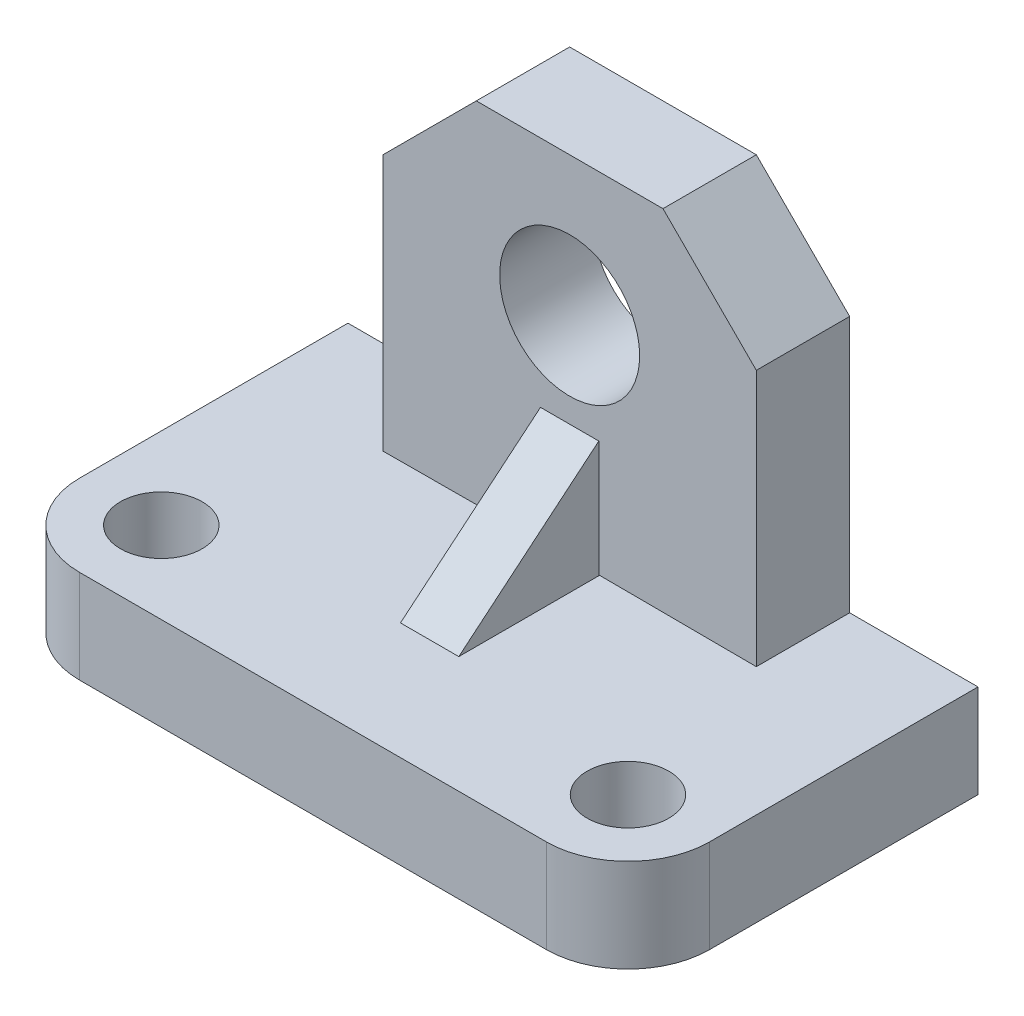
SolidWorks part; units mm, degrees
ref_plane "前视基准面" through (0, 0, 0) normal (0, 0, 1) x (1, 0, 0)
ref_plane "上视基准面" through (0, 0, 0) normal (0, 1, 0) x (1, 0, 0)
ref_plane "右视基准面" through (0, 0, 0) normal (1, 0, 0) x (0, 0, -1)
sketch "草图1" plane through (0, 0, 0) normal (0, 1, 0) x (1, 0, 0)
  line L0 (0, 22.9704) -> (0, -68.59) construction
  line L1 (27, 0) -> (-27, 0)
  line L2 (-27, 0) -> (-27, -23)
  line L3 (-20, -30) -> (20, -30)
  line L4 (-20, -15.9026) -> (-20, -39.6762) construction
  line L5 (-11.9684, -23) -> (-5.1768, -23) construction
  line L6 (27, 0) -> (27, -23)
  circle A0 centre (-20, -23) radius 3.5
  arc A1 (-20, -30) -> (-27, -23) centre (-20, -23) cw
  circle A2 centre (20, -23) radius 3.5
  arc A3 (20, -30) -> (27, -23) centre (20, -23) ccw
  point P15 (-27, -30)
  point P20 (0, -30)
  point P21 (0, 0)
  dimension "D1" = 7
  dimension "D6" = 7
  dimension "D3" = 20
  dimension "D4" = 23
extrude "凸台-拉伸1" add sketch "草图1" along normal blind 8
sketch "草图2" plane through (0, 0, 0) normal (0, 0, 1) x (1, 0, 0)
  line L0 (0, -1.9012) -> (0, 46.989) construction
  line L1 (0, 8.0772) -> (-16, 8)
  line L2 (-20, 8) -> (20, 8) construction
  line L3 (-16, 8) -> (-16, 30)
  line L4 (-16, 30) -> (-8, 38)
  line L5 (-8, 38) -> (8, 38)
  line L6 (-5.5793, 26.0772) -> (7.7251, 26.0772) construction
  line L7 (16, 30) -> (8, 38)
  line L8 (16, 8) -> (16, 30)
  line L9 (0, 8.0772) -> (16, 8)
  circle A0 centre (0, 26.0772) radius 6
  point P15 (0, 38)
  dimension "D1" = 12
  dimension "D2" = 8
  dimension "D3" = 22
  dimension "D4" = 30
  dimension "D5" = 18
  dimension "D6" = 16
extrude "凸台-拉伸2" add sketch "草图2" along normal blind 8 separate body
sketch "草图3" plane through (0, 0, 0) normal (1, 0, 0) x (0, 0, -1)
  line L0 (-8, 18) -> (-20, 8)
  line L1 (-8, 30) -> (-8, 8) construction
  line L2 (0, 8) -> (-23, 8) construction
  line L3 (-8, 18) -> (-8, 8)
  line L4 (-8, 8) -> (-20, 8)
  dimension "D1" = 12
  dimension "D2" = 10
extrude "凸台-拉伸8" add sketch "草图3" along normal mid plane 5 separate body
